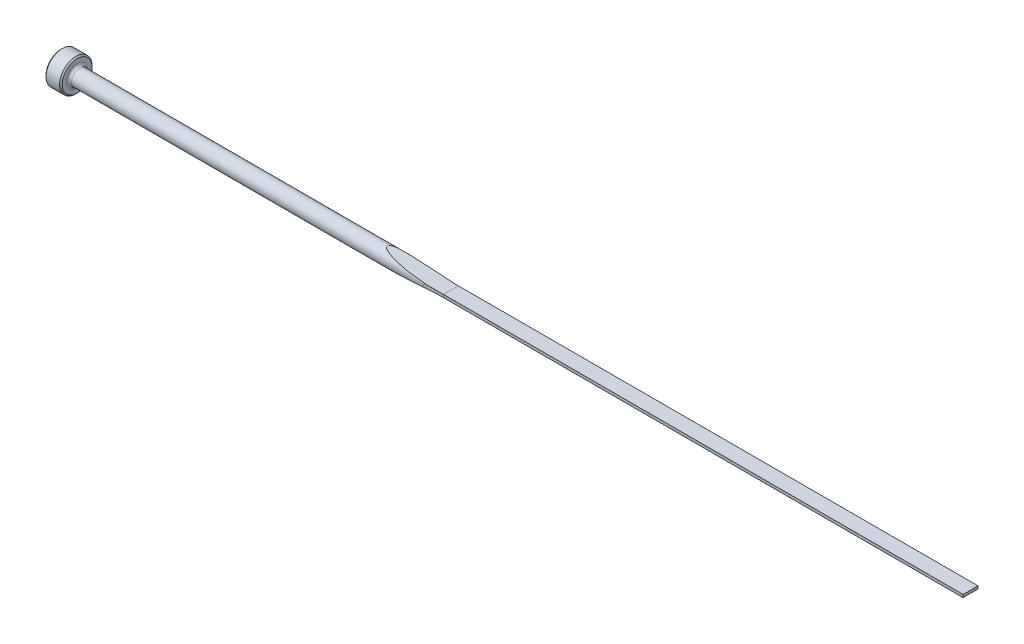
SolidWorks part; units mm, degrees
ref_plane "Front Plane" through (0, 0, 0) normal (0, 0, 1) x (1, 0, 0)
ref_plane "Top Plane" through (0, 0, 0) normal (0, 1, 0) x (1, 0, 0)
ref_plane "Right Plane" through (0, 0, 0) normal (1, 0, 0) x (0, 0, -1)
sketch "Sketch1" plane through (0, 0, 0) normal (0, 0, 1) x (1, 0, 0)
  line L0 (0, 0) -> (167.7268, 0) construction
  line L1 (0, 0) -> (0, 4.7625)
  line L2 (0, 4.7625) -> (4.7498, 4.7625)
  line L3 (4.7498, 4.7625) -> (4.7498, 2.3749)
  line L4 (4.7498, 2.3749) -> (266.7, 2.3749)
  line L5 (266.7, 2.3749) -> (266.7, 0)
  line L6 (266.7, 0) -> (0, 0)
  dimension "D1" = 266.7
  dimension "D2" = 9.525
  dimension "D3" = 4.7498
  dimension "D4" = 4.7498
revolve "Revolve1" add sketch "Sketch1" angle 360 about L0
sketch "Sketch2" plane through (0, 0, 0) normal (0, 0, 1) x (1, 0, 0)
  line L0 (266.7, 2.3749) -> (266.7, 0.4064)
  line L1 (266.7, -2.3749) -> (266.7, 2.3749) construction
  line L2 (266.7, 0.4064) -> (114.3, 0.4064)
  line L3 (266.7, 2.3749) -> (4.7498, 2.3749) construction
  line L4 (95.6956, 2.3749) -> (266.7, 2.3749)
  line L5 (166.0833, 0) -> (153.1705, 0) construction
  arc A0 (114.3, 0.4064) -> (95.6956, 2.3749) centre (114.3, 89.3064) cw
  dimension "D1" = 88.9
  dimension "D3" = 152.4
  dimension "D2" = 0.8128
  dimension "D4" = 18.6044
extrude "Cut-Extrude1" cut sketch "Sketch2" against normal through all both and the other way through all
mirror "Mirror1" about plane through (0, 0, 0) normal (0, 1, 0) of "Cut-Extrude1"
sketch "Sketch3" plane through (0, 0, 0) normal (0, 1, 0) x (1, 0, 0)
  line L0 (266.7, 2.3749) -> (266.7, 2.1844)
  line L1 (266.7, 2.3399) -> (266.7, -2.3399) construction
  line L2 (266.7, 2.1844) -> (114.3, 2.1844)
  line L3 (266.7, 2.3749) -> (4.7498, 2.3749) construction
  line L4 (108.4832, 2.3749) -> (266.7, 2.3749)
  line L5 (163.4716, 0) -> (166.2513, 0) construction
  line L6 (114.3, 2.3399) -> (114.3, -2.3399) construction
  arc A0 (114.3, 2.1844) -> (108.4832, 2.3749) centre (114.3, 91.0844) cw
  dimension "D2" = 88.9
  dimension "D1" = 4.3688
extrude "Cut-Extrude2" cut sketch "Sketch3" against normal through all both and the other way through all
mirror "Mirror2" about plane through (0, 0, 0) normal (0, 0, 1) of "Cut-Extrude2"
fillet "Fillet1" radius 0.762 1 edges at (4.7498, 0, 2.3749)
chamfer "Chamfer1" distance 0.381 angle 45 2 edges at (0, 0, 4.7625) (4.7498, 0, 4.7625)
